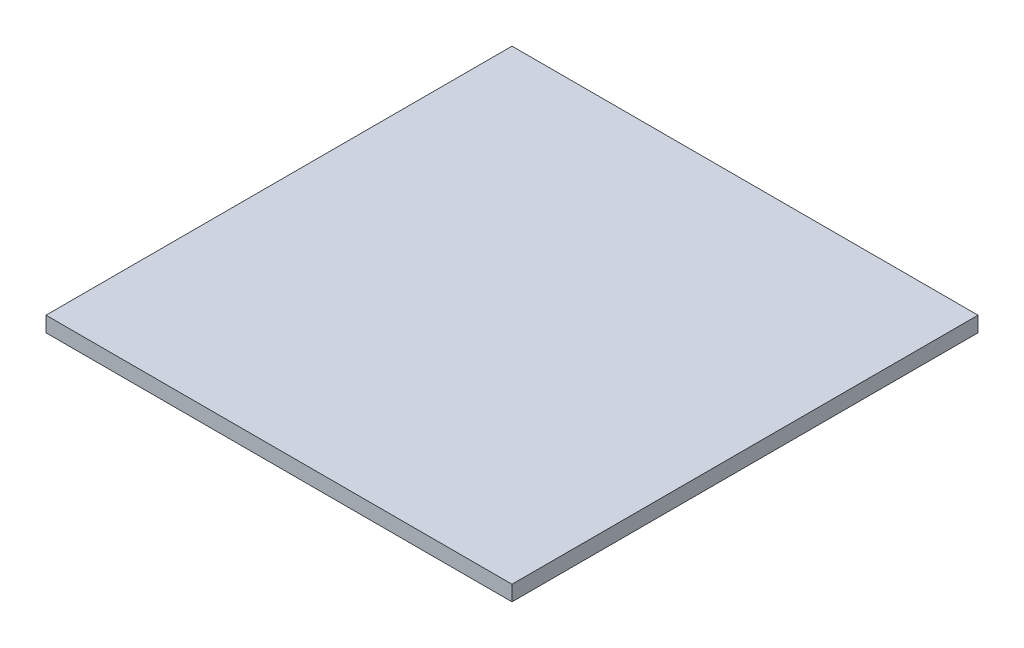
SolidWorks part; units mm, degrees
ref_plane "Front Plane" through (0, 0, 0) normal (0, 0, 1) x (1, 0, 0)
ref_plane "Top Plane" through (0, 0, 0) normal (0, 1, 0) x (1, 0, 0)
ref_plane "Right Plane" through (0, 0, 0) normal (1, 0, 0) x (0, 0, -1)
sketch "Sketch1" plane through (0, 0, 0) normal (0, 1, 0) x (1, 0, 0)
  line L1 (-19.05, 19.05) -> (19.05, 19.05)
  line L2 (-19.05, 19.05) -> (-19.05, -19.05)
  line L3 (-19.05, -19.05) -> (19.05, -19.05)
  line L4 (19.05, 19.05) -> (19.05, -19.05)
  dimension "D1" = 38.1
  dimension "D2" = 38.1
  dimension "D3" = 19.05
  dimension "D4" = 19.05
extrude "Boss-Extrude1" add sketch "Sketch1" along normal blind 1.25
